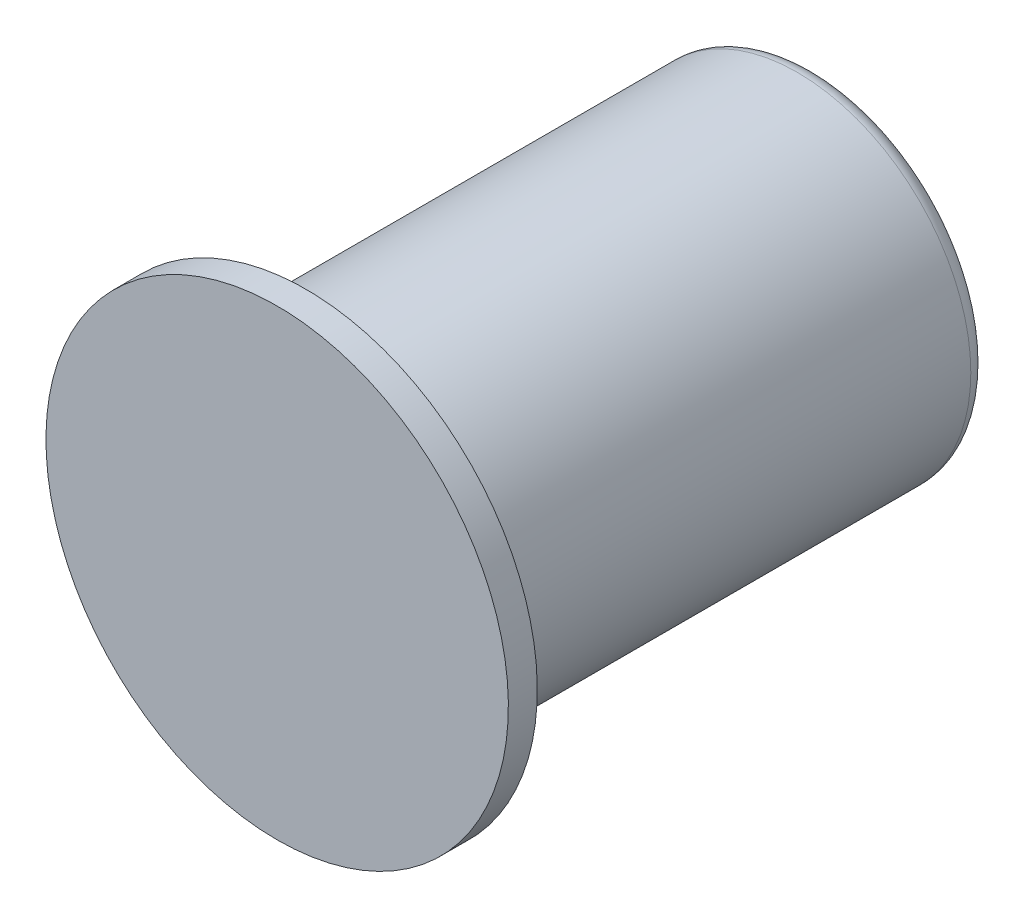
SolidWorks part; units mm, degrees
ref_plane "Front Plane" through (0, 0, 0) normal (0, 0, 1) x (1, 0, 0)
ref_plane "Top Plane" through (0, 0, 0) normal (0, 1, 0) x (1, 0, 0)
ref_plane "Right Plane" through (0, 0, 0) normal (1, 0, 0) x (0, 0, -1)
sketch "Sketch1" plane through (0, 0, 0) normal (1, 0, 0) x (0, 0, -1)
  line L0 (0, 0) -> (93, 0) construction
  line L1 (0, 0) -> (0, 40)
  line L2 (0, 40) -> (5, 40)
  line L3 (5, 40) -> (5, 30)
  line L4 (5, 30) -> (90, 30)
  line L5 (93, 27) -> (93, 5.5)
  line L6 (92.5, 5) -> (84, 5)
  line L7 (84, 5) -> (81.1132, 0)
  line L8 (92.5, 5) -> (93, 5.5)
  line L9 (0, 0) -> (81.1132, 0)
  arc A0 (90, 30) -> (93, 27) centre (90, 27) cw
  dimension "D1" = 3
  dimension "D2" = 5
  dimension "D3" = 88
  dimension "D4" = 30
  dimension "D5" = 40
  dimension "D6" = 9
  dimension "D7" = 60
  dimension "D8" = 45
  dimension "D9" = 0.5
  dimension "D10" = 5
revolve "Revolve1" add sketch "Sketch1" angle 360 about L0
